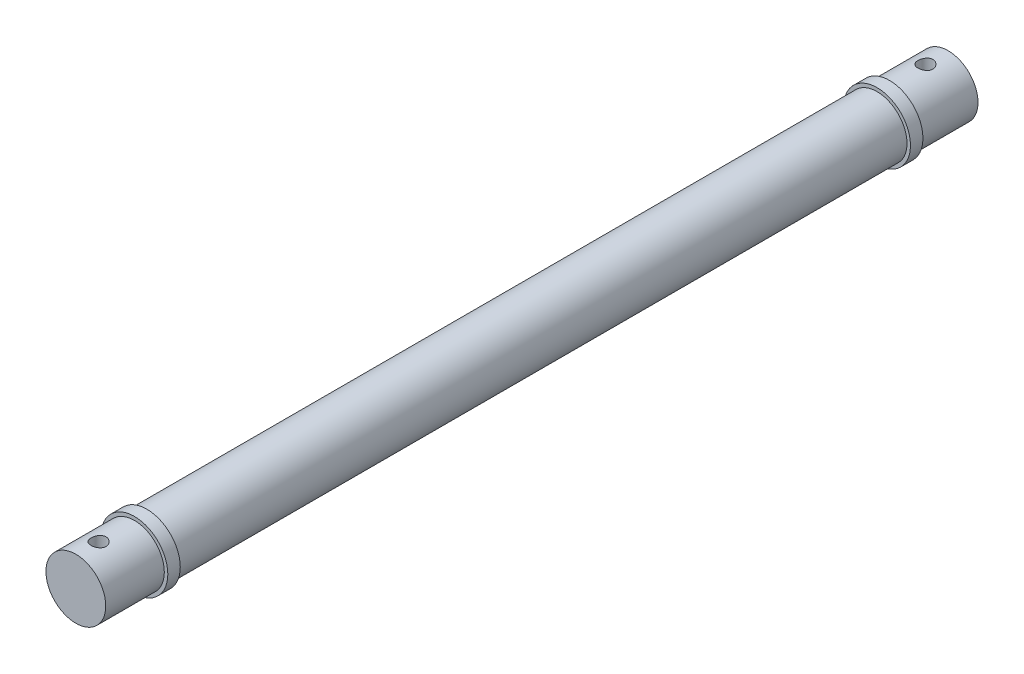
SolidWorks part; units mm, degrees
ref_plane "Front Plane" through (0, 0, 0) normal (0, 0, 1) x (1, 0, 0)
ref_plane "Top Plane" through (0, 0, 0) normal (0, 1, 0) x (1, 0, 0)
ref_plane "Right Plane" through (0, 0, 0) normal (1, 0, 0) x (0, 0, -1)
sketch "Sketch1" plane through (0, 0, 0) normal (0, 0, 1) x (1, 0, 0)
  circle A0 centre (0, 0) radius 2.4
  dimension "D1" = 4.8
extrude "Boss-Extrude1" add sketch "Sketch1" along normal blind 70
ref_plane "Plane1" through (0, 0, 5.7) normal (0, 0, -1) x (-1, 0, 0)
sketch "Sketch2" plane through (0, 0, 5.7) normal (0, 0, -1) x (-1, 0, 0)
  circle A0 centre (0, 0) radius 2.68
  circle A1 centre (0, 0) radius 2.4
extrude "Boss-Extrude3" add sketch "Sketch2" along normal blind 1 separate body
ref_plane "Plane3" through (0, 0, 64.3) normal (0, 0, 1) x (1, 0, 0)
sketch "Sketch3" plane through (0, 0, 64.3) normal (0, 0, 1) x (1, 0, 0)
  circle A0 centre (0, 0) radius 2.68
  circle A1 centre (0, 0) radius 2.4
extrude "Boss-Extrude4" add sketch "Sketch3" along normal blind 1 separate body
sketch "Sketch4" plane through (0, 0, 0) normal (0, 1, 0) x (1, 0, 0)
  circle A0 centre (0, -1.8215) radius 0.6
extrude "Cut-Extrude1" cut sketch "Sketch4" against normal mid plane 10
ref_plane "Plane4" through (0, 0, 35) normal (0, 0, 1) x (1, 0, 0)
mirror "Mirror1" about plane through (0, 0, 35) normal (0, 0, 1) of "Cut-Extrude1"
